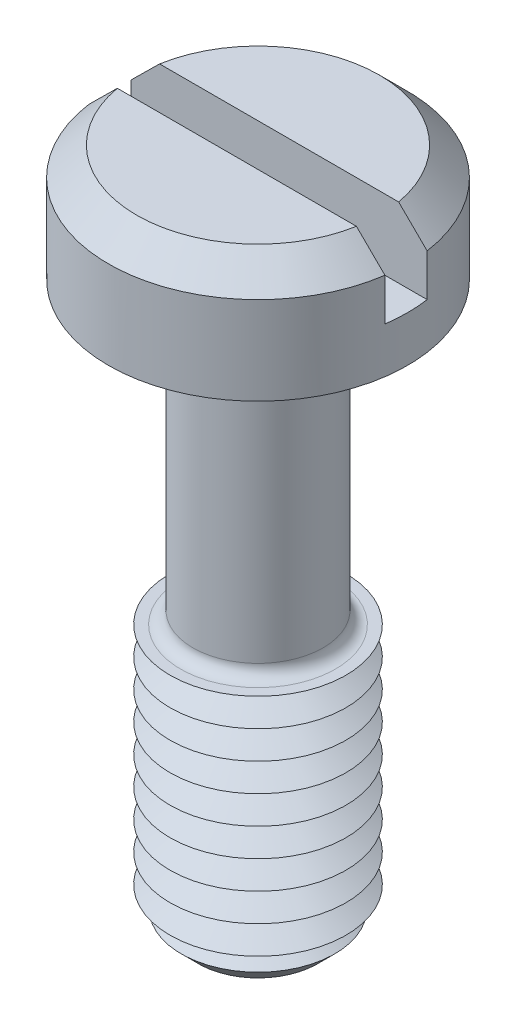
SolidWorks part; units mm, degrees
ref_plane "Front Plane" through (0, 0, 0) normal (0, 0, 1) x (1, 0, 0)
ref_plane "Top Plane" through (0, 0, 0) normal (0, 1, 0) x (1, 0, 0)
ref_plane "Right Plane" through (0, 0, 0) normal (1, 0, 0) x (0, 0, -1)
sketch "Sketch1" plane through (0, 0, 0) normal (0, 1, 0) x (1, 0, 0)
  circle A0 centre (0, 0) radius 4.25
  dimension "D1" = 8.5
extrude "Boss-Extrude1" add sketch "Sketch1" along normal blind 3.3
sketch "Sketch2" plane through (0, 0, 0) normal (0, -1, 0) x (1, 0, 0)
  circle A0 centre (0, 0) radius 1.85
  dimension "D1" = 3.7
extrude "Boss-Extrude2" add sketch "Sketch2" along normal blind 16
sketch "Sketch3" plane through (0, -16, 0) normal (0, -1, 0) x (1, 0, 0)
  circle A0 centre (0, 0) radius 2.5
  dimension "D1" = 5
extrude "Boss-Extrude3" add sketch "Sketch3" against normal blind 7.5
chamfer "Chamfer1" distance 0.8 angle 45 1 edges at (0, -16, -2.5)
sketch "Sketch4" plane through (0, 0, 0) normal (1, 0, 0) x (0, 0, -1)
  line L0 (0, -6.5871) -> (0, -12.0372) construction
sketch "Sketch5" plane through (0, 0, 0) normal (1, 0, 0) x (0, 0, -1)
  line L0 (-2.5, -8.5) -> (-1.8072, -8.9)
  line L1 (-1.8072, -8.9) -> (-2.5, -9.3)
  line L2 (-2.5, -8.5) -> (-2.5, -15.2) construction
  line L3 (-2.5, -9.3) -> (-2.5, -8.5)
  dimension "D1" = 0.8
revolve "Cut-Revolve1" cut sketch "Sketch5" angle 360 about L0
pattern_linear "LPattern1" count 9 spacing 0.8 along (0, -1, 0) of "Cut-Revolve1"
fillet "Fillet1" radius 0.35 2 edges at (0, -8.5, -1.85) (0, 0, -1.85)
chamfer "Chamfer2" distance 0.8 angle 45 1 edges at (0, 3.3, 4.25)
sketch "Sketch6" plane through (0, 3.3, 0) normal (0, 1, 0) x (1, 0, 0)
  line L1 (4.25, -0.6) -> (-4.25, -0.6)
  line L2 (4.25, -0.6) -> (4.25, 0.6)
  line L3 (4.25, 0.6) -> (-4.25, 0.6)
  line L4 (-4.25, -0.6) -> (-4.25, 0.6)
  line L5 (4.25, -0.6) -> (-4.25, 0.6) construction
  line L6 (4.25, 0.6) -> (-4.25, -0.6) construction
  circle A0 centre (0, 0) radius 4.25 construction
  point P0 (0, 0)
  dimension "D1" = 1.2
extrude "Cut-Extrude1" cut sketch "Sketch6" against normal blind 2
